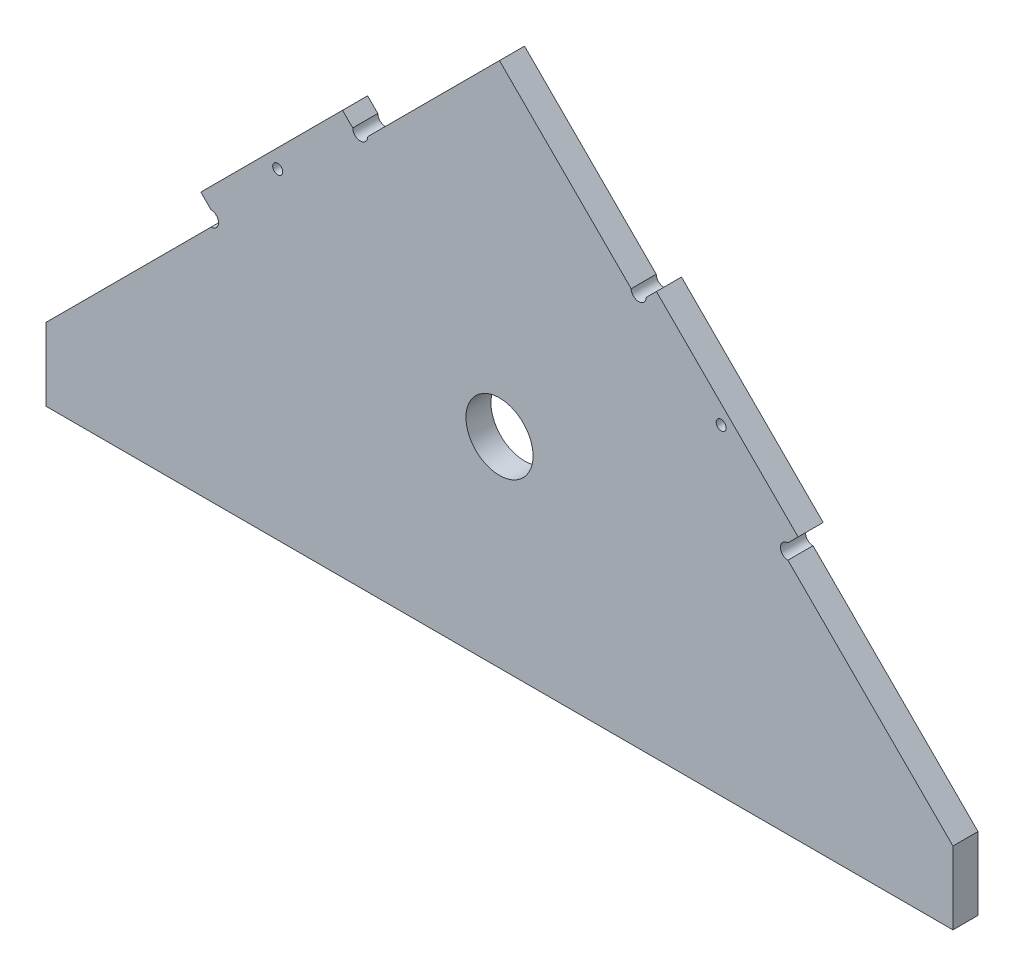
SolidWorks part; units mm, degrees
ref_plane "Plan de face" through (0, 0, 0) normal (0, 0, 1) x (1, 0, 0)
ref_plane "Plan de dessus" through (0, 0, 0) normal (0, 1, 0) x (1, 0, 0)
ref_plane "Plan de droite" through (0, 0, 0) normal (1, 0, 0) x (0, 0, -1)
sketch "Esquisse1" plane through (0, 0, 0) normal (0, 0, 1) x (1, 0, 0)
  line L0 (90.5, 0) -> (-90.5, 0)
  line L1 (-31.3198, 80.7513) -> (-56.0685, 48.9315) construction
  line L2 (-56.0685, 48.9315) -> (-76.2084, 48.9315) construction
  line L3 (0, 105) -> (0, 0) construction
  line L4 (90.5, 14.5) -> (57.5685, 47.4315)
  line L5 (90.5, 0) -> (90.5, 14.5)
  line L6 (-27.7843, 77.2157) -> (-27.7843, 93.005) construction
  line L7 (-26.2843, 78.7157) -> (0, 105)
  line L8 (-59.6041, 52.467) -> (-57.5685, 50.4315)
  line L9 (-31.3198, 80.7513) -> (-59.6041, 52.467)
  line L10 (29.2843, 78.7157) -> (31.3198, 80.7513)
  line L11 (31.3198, 80.7513) -> (59.6041, 52.467)
  line L12 (59.6041, 52.467) -> (57.5685, 50.4315)
  line L13 (26.2843, 78.7157) -> (0, 105)
  line L14 (-29.2843, 78.7157) -> (-31.3198, 80.7513)
  line L15 (-90.5, 0) -> (-90.5, 14.5)
  line L16 (27.7843, 77.2157) -> (27.7843, 93.005) construction
  line L17 (56.0685, 48.9315) -> (76.2084, 48.9315) construction
  line L18 (-90.5, 14.5) -> (-57.5685, 47.4315)
  line L19 (31.3198, 80.7513) -> (56.0685, 48.9315) construction
  circle A0 centre (-44.2534, 64.1224) radius 1
  arc A1 (-26.2843, 78.7157) -> (-29.2843, 78.7157) centre (-27.7843, 78.7157) cw
  arc A2 (57.5685, 50.4315) -> (57.5685, 47.4315) centre (57.5685, 48.9315) ccw
  arc A3 (26.2843, 78.7157) -> (29.2843, 78.7157) centre (27.7843, 78.7157) ccw
  arc A4 (-57.5685, 50.4315) -> (-57.5685, 47.4315) centre (-57.5685, 48.9315) cw
  circle A5 centre (44.2534, 64.1224) radius 1
  dimension "D1" = 90
  dimension "D2" = 90
  dimension "D3" = 181
extrude "Boss.-Extru.1" add sketch "Esquisse1" along normal blind 5
sketch "Esquisse2" plane through (0, 0, 5) normal (0, 0, 1) x (1, 0, 0)
  line L0 (0, 0) -> (0, 40) construction
  line L1 (-90.5, 0) -> (90.5, 0) construction
  circle A0 centre (0, 40) radius 6.7
  dimension "D2" = 13.4
  dimension "D1" = 40
extrude "Enlèv. mat.-Extru.1" cut sketch "Esquisse2" against normal blind 10
